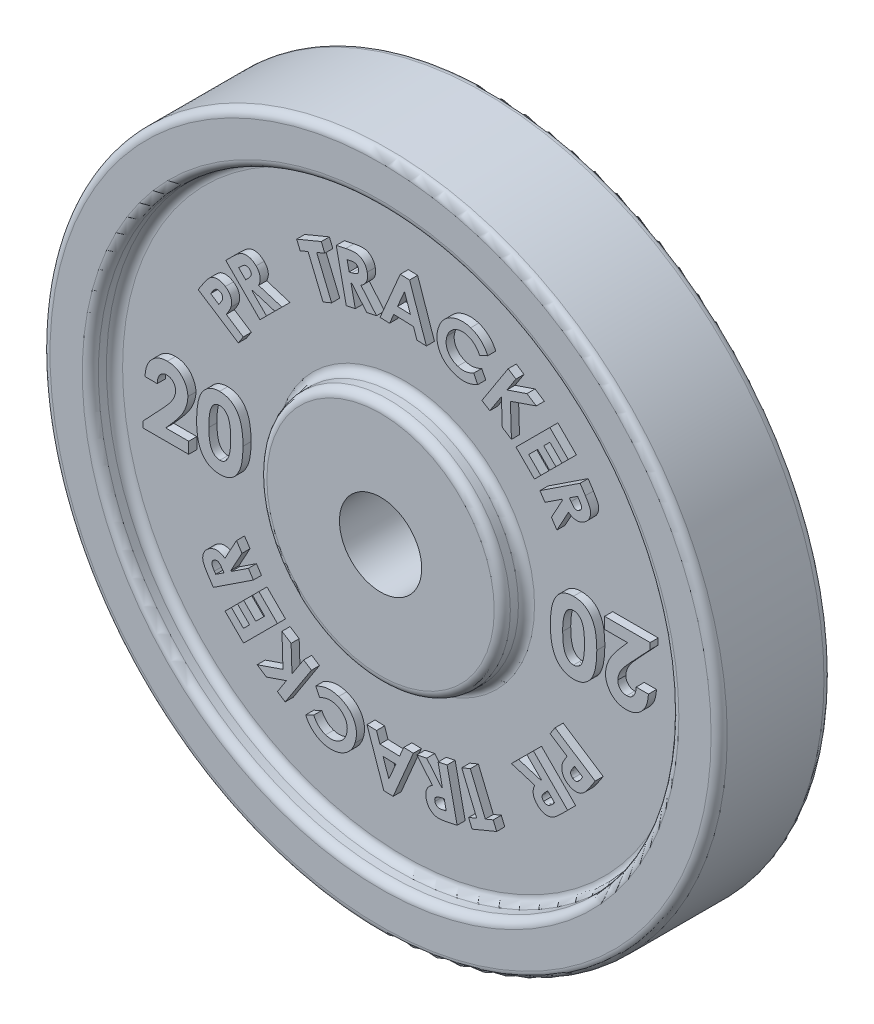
SolidWorks part; units mm, degrees
ref_plane "Plano frontal" through (0, 0, 0) normal (0, 0, 1) x (1, 0, 0)
ref_plane "Plano superior" through (0, 0, 0) normal (0, 1, 0) x (1, 0, 0)
ref_plane "Plano direito" through (0, 0, 0) normal (1, 0, 0) x (0, 0, -1)
sketch "Esboço1" plane through (0, 0, 0) normal (0, 0, 1) x (1, 0, 0)
  circle A0 centre (0, 0) radius 21
  circle A1 centre (0, 0) radius 2.55
  dimension "D1" = 42
  dimension "D2" = 5.1
extrude "Ressalto-extrusão1" add sketch "Esboço1" along normal blind 7
sketch "Esboço2" plane through (0, 0, 7) normal (0, 0, 1) x (1, 0, 0)
  circle A0 centre (0, 0) radius 18
  circle A1 centre (0, 0) radius 21
  circle A2 centre (0, 0) radius 21
  circle A5 centre (0, 0) radius 7.55
  circle A6 centre (0, 0) radius 7.55
  dimension "D1" = 0
  dimension "D2" = 3
  dimension "D3" = 5
extrude "Corte-extrusão1" cut sketch "Esboço2" against normal blind 1.5 contours A0 A6
fillet "Filete1" radius 0.5 4 edges at (7.55, 0, 5.5) (18, 0, 5.5) (7.55, 0, 7) (18, 0, 7)
sketch "Esboço3" plane through (0, 0, 5.5) normal (0, 0, 1) x (1, 0, 0)
  arc A0 (11.25, 0) -> (-11.25, 0) centre (0, 0) ccw construction
  text T0 "<b>PR  TRACKER</b>" font "Century Gothic" height 3
  dimension "D1" = 22.5
extrude "Ressalto-extrusão2" add sketch "Esboço3" along normal blind 0.5
sketch "Esboço5" plane through (0, 0, 5.5) normal (0, 0, 1) x (1, 0, 0)
  line L0 (-17.3735, -2.1) -> (-7.7713, -2.1) construction
  line L1 (0, 0) -> (-17.5, 0) construction
  circle A2 centre (0, 0) radius 17.5 construction
  circle A3 centre (0, 0) radius 8.05 construction
  text T0 "20  " font "Century Gothic" height in points 16
  dimension "D1" = 2.1
extrude "Ressalto-extrusão3" add sketch "Esboço5" along normal blind 0.5
pattern_circular "PadrãoCircular1" count 2 over 360 about axis through (0, 0, 7) along (0, 0, 1) of "Ressalto-extrusão2", "Ressalto-extrusão3"
ref_plane "Plano1" through (0, 0, 3.5) normal (0, 0, 1) x (1, 0, 0)
fillet "Filete2" radius 0.5 2 edges at (21, 0, 0) (21, 0, 7)
mirror "Espelhar6" about plane through (0, 0, 3.5) normal (0, 0, 1) of "Corte-extrusão1"
fillet "Filete3" radius 0.5 4 edges at (18, 0, 1.5) (7.55, 0, 0) (18, 0, 0) (7.55, 0, 1.5)
sketch "Esboço10" plane through (0, 0, 1.5) normal (0, 0, -1) x (-1, 0, 0)
  line L0 (-11.25, 0) -> (11.25, 0) construction
  arc A0 (11.25, 0) -> (-11.25, 0) centre (0, 0) ccw construction
  text T0 "<b>PR  TRACKER</b>" font "Century Gothic" height 3
  dimension "D1" = 22.5
extrude "Ressalto-extrusão4" add sketch "Esboço10" along normal blind 0.5
sketch "Esboço12" plane through (0, 0, 1.5) normal (0, 0, -1) x (-1, 0, 0)
  line L0 (-17.3735, -2.1) -> (-7.2521, -2.1) construction
  circle A0 centre (0, 0) radius 17.5 construction
  circle A1 centre (0, 0) radius 7.55 construction
  text T0 "<b>20</b>  " font "Century Gothic" height in points 16
  dimension "D1" = 2.1
extrude "Ressalto-extrusão5" add sketch "Esboço12" along normal blind 0.5
pattern_circular "PadrãoCircular2" count 2 over 360 about axis through (0, 0, 0) along (0, 0, 1) of "Ressalto-extrusão4", "Ressalto-extrusão5"
